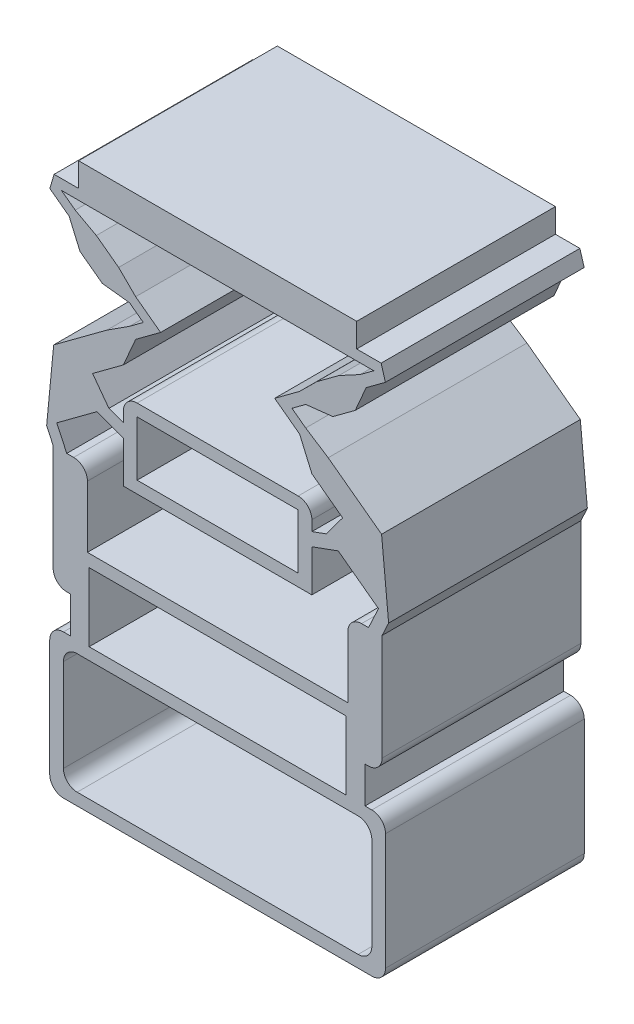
SolidWorks part; units mm, degrees
ref_plane "前视基准面" through (0, 0, 0) normal (0, 0, 1) x (1, 0, 0)
ref_plane "上视基准面" through (0, 0, 0) normal (0, 1, 0) x (1, 0, 0)
ref_plane "右视基准面" through (0, 0, 0) normal (1, 0, 0) x (0, 0, -1)
other "Configuration Table"
sketch "草图1" plane through (0, 0, 0) normal (0, 0, 1) x (1, 0, 0)
  line L0 (2.75, 5.15) -> (3.1729, 5.3039)
  line L1 (-3.8, -1.35) -> (3.8, -1.35)
  line L2 (-3.8, -1.35) -> (-3.8, 1.35)
  line L4 (3.8, -1.35) -> (3.8, 0.05)
  line L5 (-3.8, -1.35) -> (3.8, 1.35) construction
  line L6 (-3.8, 1.35) -> (3.8, -1.35) construction
  line L7 (-2.75, 5.15) -> (2.75, 5.15)
  line L8 (-2.75, 5.15) -> (-2.75, 3.55)
  line L9 (-2.75, 3.55) -> (2.75, 3.55)
  line L10 (2.75, 4.7669) -> (2.75, 3.55)
  line L11 (-2.75, 5.15) -> (2.75, 3.55) construction
  line L12 (-2.75, 3.55) -> (2.75, 5.15) construction
  line L14 (3.8, 0.05) -> (4.8, 0.05)
  line L17 (4.0061, 6.4289) -> (3.1729, 5.3039)
  line L19 (4.0061, 6.4289) -> (5.8544, 5.06)
  line L33 (2.75, 5.15) -> (2.75, 4.7669) construction
  line L34 (3.1729, 5.3039) -> (3.5197, 5.047) construction
  line L37 (4.8, 3.55) -> (4.8, 0.05)
  line L38 (-3.8, 1.35) -> (3.8, 1.35)
  line L39 (3.8, 1.35) -> (3.8, 0.05) construction
  line L40 (0, 9.062) -> (0, -4.0269) construction
  line L41 (2.75, 4.7669) -> (3.5197, 5.047)
  line L48 (3.5197, 5.047) -> (4.6949, 4.1765)
  line L51 (4.4028, 3.55) -> (4.6949, 4.1765)
  line L53 (4.9902, 3.9578) -> (5.0211, 3.9349)
  line L55 (4.6949, 4.1765) -> (4.9902, 3.9578) construction
  line L56 (4.4028, 3.55) -> (4.8, 3.55) construction
  line L57 (3.8, 1.35) -> (3.8, 3.55)
  line L58 (3.8, 3.55) -> (4.4028, 3.55)
  line L59 (4.8, 3.55) -> (4.9902, 3.9578)
  line L60 (5.0211, 3.9349) -> (5.8544, 5.06)
  point P0 (0, 0)
  point P6 (0, 4.35)
  dimension "D1" = 7.6
  dimension "D2" = 2.7
  dimension "D3" = 5.5
  dimension "D4" = 1.6
  dimension "D5" = 1
  dimension "D6" = 0.45
  dimension "D7" = 0.45
  dimension "D8" = 0.36
  dimension "D9" = 3.5
  dimension "D10" = 1.4
  dimension "D11" = 0.36
  dimension "D12" = 2.2
  dimension "D13" = 65
  dimension "D14" = 2.2
  dimension "D15" = 2.3
  dimension "D16" = 110
extrude "凸台-拉伸1" add sketch "草图1" along normal blind 5.8
mirror "镜向1" about plane through (0, 0, 0) normal (1, 0, 0) of "凸台-拉伸1"
sketch "草图10" plane through (0, 0, 5.8) normal (0, 0, 1) x (1, 0, 0)
  line L0 (-2.75, 3.55) -> (2.75, 3.55) construction
  line L1 (-3.75, -1) -> (3.75, -1)
  line L2 (-3.75, -1) -> (-3.75, 1)
  line L3 (-3.75, 1) -> (3.75, 1)
  line L4 (3.75, -1) -> (3.75, 1)
  line L5 (-3.75, -1) -> (3.75, 1) construction
  line L6 (-3.75, 1) -> (3.75, -1) construction
  line L7 (-2.35, 5.5) -> (2.35, 5.5)
  line L8 (-2.35, 5.5) -> (-2.35, 3.9)
  line L9 (-2.35, 3.9) -> (2.35, 3.9)
  line L10 (2.35, 5.5) -> (2.35, 3.9)
  point P0 (0, 0)
  point P10 (0, 5.5)
  dimension "D1" = 7.5
  dimension "D2" = 2
  dimension "D3" = 4.7
  dimension "D4" = 1.6
  dimension "D5" = 0.35
extrude "切除-拉伸3" cut sketch "草图10" against normal through all
sketch "草图11" plane through (0, 0, 5.8) normal (0, 0, 1) x (1, 0, 0)
  line L0 (-2.35, 5.15) -> (-2.75, 5.15)
  line L1 (-2.75, 5.15) -> (-2.75, 5.85)
  line L2 (-2.75, 5.85) -> (2.75, 5.85)
  line L3 (2.75, 5.85) -> (2.75, 5.15)
  line L4 (2.75, 3.55) -> (2.75, 4.7669) construction
  line L5 (2.75, 5.15) -> (2.35, 5.15)
  line L6 (2.35, 5.15) -> (2.35, 5.5)
  line L7 (2.35, 5.5) -> (-2.35, 5.5)
  line L8 (-2.35, 5.5) -> (-2.35, 5.15)
  line L9 (-2.35, 3.9) -> (2.35, 3.9) construction
  dimension "D1" = 0.35
  dimension "D2" = 1.6
extrude "凸台-拉伸2" add sketch "草图11" against normal up to surface (5.8 mm away)
fillet "圆角1" radius 0.4 2 edges at (-2.75, 5.85, 2.9) (2.75, 5.85, 2.9)
sketch "草图13" plane through (0, 0, 5.8) normal (0, 0, 1) x (1, 0, 0)
  line L4 (-4.9902, 3.9578) -> (-4.8105, 5.8331)
  line L8 (-5.8544, 5.06) -> (-4.0061, 6.4289) construction
  line L9 (-4.8105, 5.8331) -> (-5.8544, 5.06)
  line L10 (-5.8544, 5.06) -> (-5.0211, 3.9349)
  line L11 (-5.0211, 3.9349) -> (-4.9902, 3.9578)
  line L12 (4.9902, 3.9578) -> (5.0211, 3.9349)
  line L13 (5.0211, 3.9349) -> (5.8544, 5.06)
  line L14 (5.8544, 5.06) -> (4.8105, 5.8331)
  line L15 (5.8544, 5.06) -> (4.0061, 6.4289) construction
  line L16 (4.8105, 5.8331) -> (4.9902, 3.9578)
  dimension "D1" = 48
  dimension "D2" = 48
extrude "切除-拉伸4" cut sketch "草图13" against normal through all
sketch "草图14" plane through (0, 0, 5.8) normal (0, 0, 1) x (1, 0, 0)
  line L0 (3.75, -1) -> (3.75, 1) construction
  line L1 (-3.75, 1) -> (3.75, 1)
  line L2 (-3.75, 1) -> (-3.75, 0.99)
  line L3 (-3.75, 0.99) -> (3.75, 0.99)
  line L4 (3.75, 1) -> (3.75, 0.99)
  line L5 (3.8, -1.35) -> (3.8, 0.05) construction
  line L6 (-3.8, -1.35) -> (3.8, -1.35)
  line L7 (-3.8, -1.35) -> (-3.8, -1.36)
  line L8 (-3.8, -1.36) -> (3.8, -1.36)
  line L9 (3.8, -1.35) -> (3.8, -1.36)
  dimension "D1" = 0.01
  dimension "D2" = 0.01
extrude "凸台-拉伸4" add sketch "草图14" against normal up to surface (5.8 mm away)
sketch "草图15" plane through (0, 0, 5.8) normal (0, 0, 1) x (1, 0, 0)
  line L0 (3.75, -1) -> (3.75, 0.99) construction
  line L1 (-3.75, -1) -> (3.75, -1)
  line L2 (-3.75, -1) -> (-3.75, -1.01)
  line L3 (-3.75, -1.01) -> (3.75, -1.01)
  line L4 (3.75, -1) -> (3.75, -1.01)
  dimension "D1" = 0.01
extrude "切除-拉伸5" cut sketch "草图15" against normal through all
sketch "草图12" plane through (0, 0, 5.8) normal (0, 0, 1) x (1, 0, 0)
  line L0 (-4.0061, 6.4289) -> (-1.9168, 7.9764) construction
  line L1 (-4.8105, 5.8331) -> (-4.0061, 6.4289) construction
  line L2 (-1.9168, 7.9764) -> (-4.8097, 10.1192) construction
  line L3 (-2.5706, 7.6788) -> (-2.1689, 7.9764)
  line L5 (-2.6004, 7.719) -> (-2.5706, 7.6788) construction
  line L6 (-2.8087, 7.9526) -> (-2.5706, 8.274) construction
  line L7 (-4.0061, 6.4289) -> (-3.1729, 5.3039) construction
  line L8 (-2.3921, 7.4378) -> (-2.1242, 7.0762) construction
  line L18 (-2.1242, 7.0762) -> (-2.6004, 7.719) construction
  line L19 (-2.1242, 7.0762) -> (-3.649, 5.9468) construction
  line L20 (-4.0061, 6.4289) -> (-1.9168, 7.9764) construction
  line L53 (-2.1689, 7.9764) -> (-2.5706, 8.274)
  line L54 (-2.3921, 7.4378) -> (-1.6648, 7.9764)
  line L55 (-1.6648, 7.9764) -> (-2.3921, 8.5151)
  line L56 (-4.8105, 5.8331) -> (-4.7848, 6.101)
  line L57 (-4.7848, 6.101) -> (-2.6004, 7.719) construction
  line L58 (-4.9902, 3.9578) -> (-4.8105, 5.8331) construction
  line L59 (-4.3345, 9.5805) -> (-5.0617, 10.1192) construction
  line L60 (-2.3921, 7.4378) -> (-2.5706, 7.6788) construction
  line L61 (-2.5706, 8.274) -> (-2.3921, 8.5151) construction
  line L62 (-2.8087, 7.9526) -> (-2.3326, 8.5955) construction
  line L63 (-2.3326, 8.5955) -> (-4.0964, 9.9019) construction
  line L64 (-2.8087, 7.9526) -> (-4.5726, 9.2591) construction
  line L65 (-4.5726, 9.2591) -> (-4.0964, 9.9019) construction
  line L66 (-5.0617, 10.1192) -> (-5.0617, 10.4192) construction
  line L67 (-4.8097, 10.1192) -> (4.8783, 10.1192) construction
  line L68 (-4.1559, 9.8216) -> (-4.5577, 10.1192)
  line L69 (-4.5577, 10.1192) -> (-4.0577, 10.1192)
  line L70 (-4.0577, 10.1192) -> (-4.0577, 11.1192) construction
  line L74 (-5.0617, 10.4192) -> (-4.0577, 10.4192) construction
  line L75 (-2.3326, 8.5955) -> (-2.3921, 8.5151) construction
  line L76 (-4.8105, 5.8331) -> (-4.0061, 6.4289)
  line L77 (-4.0061, 6.4289) -> (-3.649, 5.9468)
  line L78 (-4.5726, 9.2591) -> (-4.3345, 9.5805) construction
  line L79 (-4.1559, 9.8216) -> (-4.0964, 9.9019) construction
  line L80 (-4.0577, 10.4192) -> (-4.0577, 11.1192)
  line L81 (0, 7.7035) -> (0, 13.757) construction
  line L105 (4.0061, 6.4289) -> (2.0776, 7.8574) construction
  line L106 (2.0776, 7.8574) -> (4.8783, 10.1192) construction
  line L107 (-4.7848, 6.101) -> (-3.2267, 7.2551)
  line L108 (-3.2267, 7.2551) -> (-2.5706, 7.6788)
  line L109 (-3.649, 5.9468) -> (-2.7506, 6.6122)
  line L110 (-2.7506, 6.6122) -> (-2.3921, 7.4378)
  line L111 (-2.5706, 8.274) -> (-3.3655, 8.365)
  line L112 (-3.3655, 8.365) -> (-4.0158, 8.8467)
  line L113 (-4.0158, 8.8467) -> (-4.3345, 9.5805)
  line L114 (-2.3921, 8.5151) -> (-2.8893, 9.0078)
  line L115 (-2.8893, 9.0078) -> (-3.5397, 9.4896)
  line L116 (-3.5397, 9.4896) -> (-4.1559, 9.8216)
  line L117 (-4.3345, 9.5805) -> (-4.897, 9.9971)
  line L118 (-4.897, 9.9971) -> (-4.7718, 10.4192)
  line L119 (-4.7718, 10.4192) -> (-4.0577, 10.4192)
  line L120 (-2.7506, 6.6122) -> (-3.2267, 7.2551) construction
  line L121 (-3.3655, 8.365) -> (-2.8893, 9.0078) construction
  line L122 (-4.0158, 8.8467) -> (-3.5397, 9.4896) construction
  line L148 (4.8105, 5.8331) -> (4.0061, 6.4289) construction
  line L149 (4.0577, 10.4192) -> (4.0577, 11.1192)
  line L150 (4.1559, 9.8216) -> (4.5577, 10.1192)
  line L151 (4.5577, 10.1192) -> (4.0577, 10.1192)
  line L152 (4.7718, 10.4192) -> (4.0577, 10.4192)
  line L153 (4.897, 9.9971) -> (4.7718, 10.4192)
  line L154 (4.3345, 9.5805) -> (4.897, 9.9971)
  line L155 (4.0158, 8.8467) -> (4.3345, 9.5805)
  line L156 (3.5397, 9.4896) -> (4.1559, 9.8216)
  line L157 (2.8893, 9.0078) -> (3.5397, 9.4896)
  line L158 (3.3655, 8.365) -> (4.0158, 8.8467)
  line L159 (2.5706, 8.274) -> (3.3655, 8.365)
  line L160 (2.3921, 8.5151) -> (2.8893, 9.0078)
  line L161 (1.6648, 7.9764) -> (2.3921, 8.5151)
  line L162 (2.1689, 7.9764) -> (2.5706, 8.274)
  line L163 (2.5706, 7.6788) -> (2.1689, 7.9764)
  line L164 (2.3921, 7.4378) -> (1.6648, 7.9764)
  line L165 (2.7506, 6.6122) -> (2.3921, 7.4378)
  line L166 (3.2267, 7.2551) -> (2.5706, 7.6788)
  line L167 (3.649, 5.9468) -> (2.7506, 6.6122)
  line L168 (4.7848, 6.101) -> (3.2267, 7.2551)
  line L169 (4.8105, 5.8331) -> (4.7848, 6.101)
  line L170 (4.0061, 6.4289) -> (3.649, 5.9468)
  line L171 (4.8105, 5.8331) -> (4.0061, 6.4289)
  line L172 (-4.0577, 11.1192) -> (4.0577, 11.1192)
  line L173 (-4.0577, 10.1192) -> (4.0577, 10.1192)
  dimension "D1" = 2.6
  dimension "D2" = 3.6
  dimension "D3" = 0.15
  dimension "D4" = 2.4
  dimension "D5" = 0.5
  dimension "D6" = 0.15
  dimension "D7" = 0.5
  dimension "D8" = 0.5
  dimension "D9" = 0.8
  dimension "D10" = 0.2
  dimension "D11" = 0.8
  dimension "D12" = 0.15
  dimension "D13" = 0.15
  dimension "D14" = 3.6
  dimension "D15" = 60
  dimension "D16" = 0.5
  dimension "D17" = 60
  dimension "D18" = 0.15
  dimension "D19" = 60
  dimension "D20" = 0.7
  dimension "D21" = 0.3
  dimension "D22" = 110
  dimension "D23" = 0.7
  dimension "D24" = 0.55
extrude "凸台-拉伸3" add sketch "草图12" against normal up to surface (5.8 mm away)
sketch "草图16" plane through (0, 0, 5.8) normal (0, 0, 1) x (1, 0, 0)
  line L0 (-4.9, -1.01) -> (4.9, -1.01)
  line L1 (-3.75, -1.01) -> (3.75, -1.01) construction
  line L2 (4.9, -1.01) -> (4.9, -5.21)
  line L3 (4.9, -5.21) -> (-4.9, -5.21)
  line L4 (-4.9, -5.21) -> (-4.9, -1.01)
  line L5 (-4.5, -1.36) -> (4.5, -1.36)
  line L6 (4.5, -1.36) -> (4.5, -4.86)
  line L7 (4.5, -4.86) -> (-4.5, -4.86)
  line L8 (-4.5, -4.86) -> (-4.5, -1.36)
  point P4 (0, -5.21)
  dimension "D1" = 0.35
  dimension "D2" = 0.4
  dimension "D3" = 0.4
  dimension "D4" = 0.35
  dimension "D5" = 3.5
  dimension "D6" = 9
extrude "凸台-拉伸5" add sketch "草图16" against normal up to surface (5.8 mm away)
fillet "圆角2" radius 0.4 10 edges at (4.8, 0.05, 2.9) (-4.8, 0.05, 2.9) (4.9, -1.01, 2.9) (-4.9, -1.01, 2.9) (-4.5, -1.36, 2.9) (4.5, -1.36, 2.9) (4.5, -4.86, 2.9) (-4.5, -4.86, 2.9) (-4.9, -5.21, 2.9) (4.9, -5.21, 2.9)
fillet "圆角3" radius 0.4 2 edges at (-3.8, 3.55, 2.9) (3.8, 3.55, 2.9)
sketch "草图17" plane through (0, 0, 0) normal (0, 0, -1) x (-1, 0, 0)
  line L5 (4.656, -5.1277) -> (-4.6452, -5.1277)
  line L6 (4.656, -5.1277) -> (4.656, -1.1983)
  line L7 (4.656, -1.1983) -> (-4.6452, -1.1983)
  line L8 (-4.6452, -5.1277) -> (-4.6452, -1.1983)
extrude "凸台-拉伸6" add sketch "草图17" against normal blind 0.3
sketch "草图18" plane through (0, 0, 5.8) normal (0, 0, 1) x (1, 0, 0)
  line L0 (-3.8, -1.01) -> (-4.5, -1.01) construction
  line L1 (-3.8, 0.05) -> (-4.3, 0.05)
  line L2 (-3.8, 0.05) -> (-3.8, -1.01)
  line L3 (-3.8, -1.01) -> (-4.3, -1.01)
  line L4 (-4.3, 0.05) -> (-4.3, -1.01)
  line L5 (4.5, -1.01) -> (3.8, -1.01) construction
  line L6 (3.8, 0.05) -> (4.3, 0.05)
  line L7 (3.8, 0.05) -> (3.8, -1.01)
  line L8 (3.8, -1.01) -> (4.3, -1.01)
  line L9 (4.3, 0.05) -> (4.3, -1.01)
  dimension "D1" = 0.5
  dimension "D2" = 0.5
extrude "凸台-拉伸7" add sketch "草图18" against normal up to surface (5.8 mm away)
